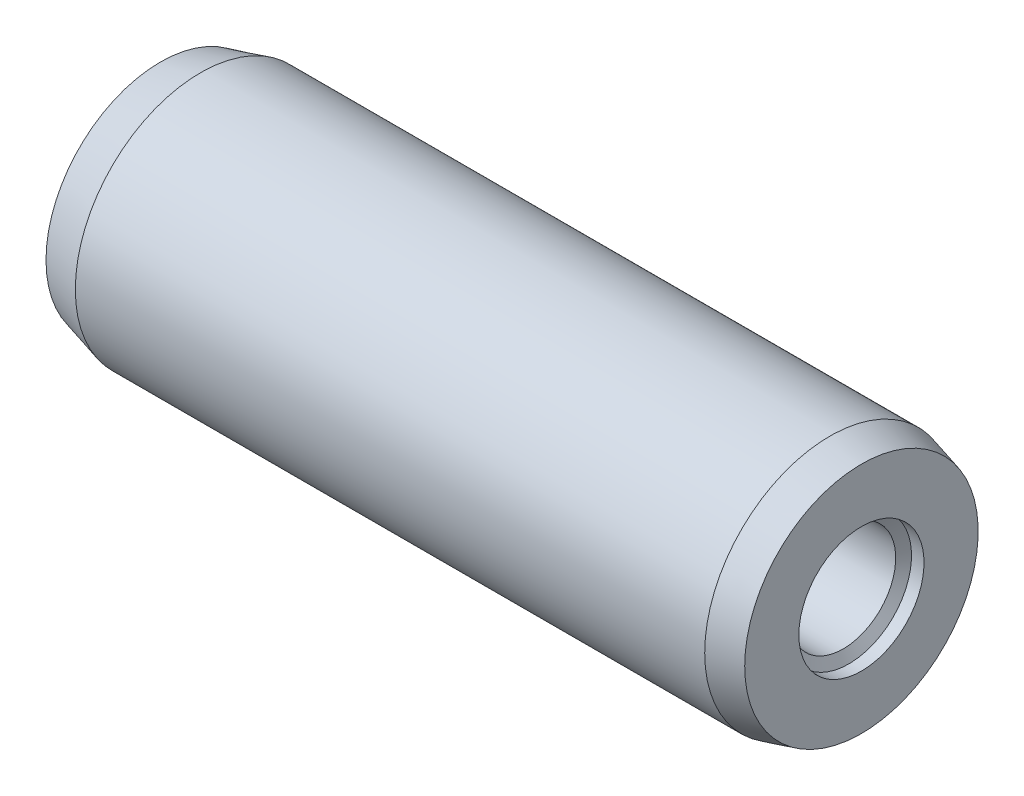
SolidWorks part; units mm, degrees
ref_plane "Plane1" through (0, 0, 0) normal (0, 0, 1) x (1, 0, 0)
ref_plane "Plane2" through (0, 0, 0) normal (0, 1, 0) x (1, 0, 0)
ref_plane "Plane3" through (0, 0, 0) normal (1, 0, 0) x (0, 0, -1)
other "Configuration Table"
sketch "Sketch1" plane through (0, 0, 0) normal (0, 0, 1) x (1, 0, 0)
  line L0 (-10, 0) -> (106, 0) construction
  line L1 (0, 0) -> (0, 22.8564)
  line L2 (8, 25) -> (133.7, 25)
  line L3 (140, 23.3119) -> (140, 12.5)
  line L4 (83.691, 0) -> (0, 0)
  line L5 (8, 25) -> (0, 22.8564)
  line L6 (140, 23.3119) -> (133.7, 25)
  line L7 (83.691, 0) -> (90, 10.5)
  line L8 (90, 10.5) -> (136.3453, 10.5)
  line L9 (136.3453, 10.5) -> (137.5, 12.5)
  line L10 (136.3453, -10.5) -> (137.5, -12.5) construction
  line L11 (137.5, 12.5) -> (140, 12.5)
  line L12 (83.691, 0) -> (90, -10.5) construction
  dimension "D1" = 15
  dimension "Length" = 140
  dimension "ChamferLength2" = 8
  dimension "D2" = 75
  dimension "ChamferLength1" = 6.3
  dimension "D3" = 120
  dimension "Diameter" = 50
  dimension "CboreDia" = 25
  dimension "D4" = 118
  dimension "CboreDepth" = 2.5
  dimension "TapDrillDepth" = 50
  dimension "TapDrillDia" = 21
revolve "Base-Revolve" add sketch "Sketch1" angle 360 about L0
